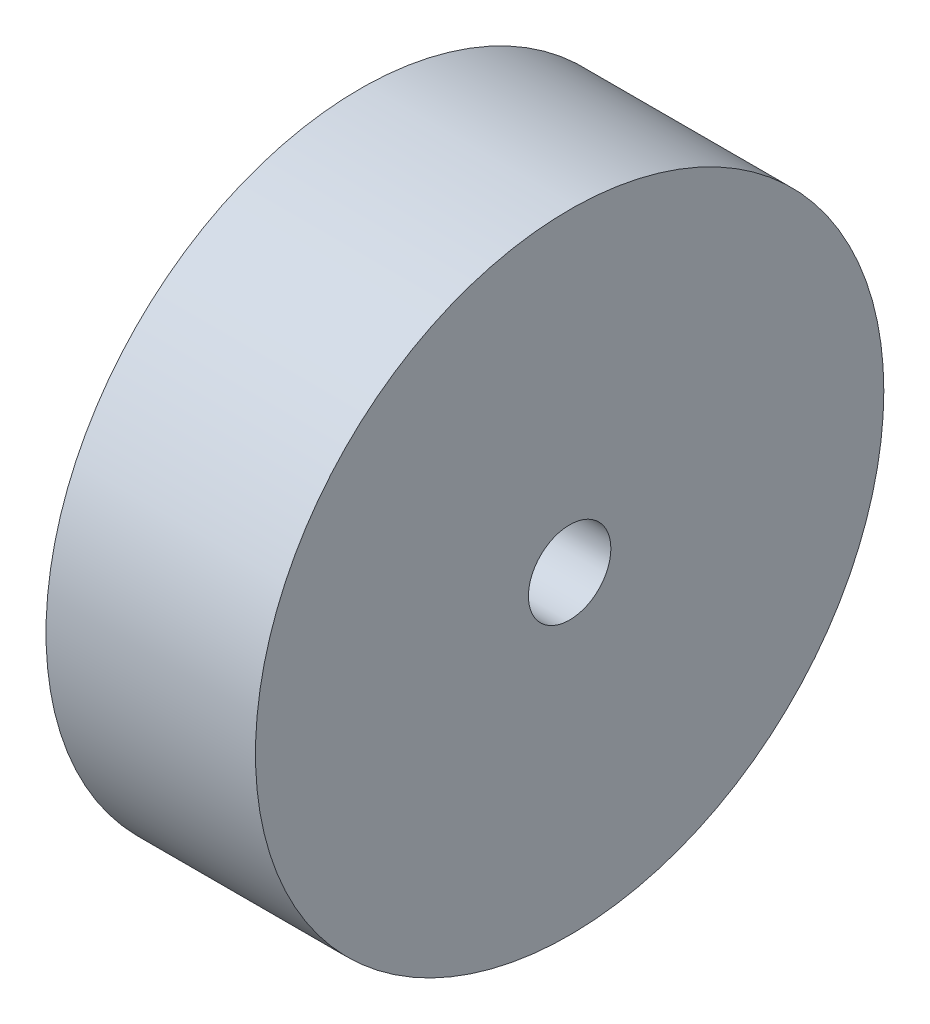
SolidWorks part; units mm, degrees
ref_plane "Front Plane" through (0, 0, 0) normal (0, 0, 1) x (1, 0, 0)
ref_plane "Top Plane" through (0, 0, 0) normal (0, 1, 0) x (1, 0, 0)
ref_plane "Right Plane" through (0, 0, 0) normal (1, 0, 0) x (0, 0, -1)
sketch "Sketch1" plane through (0, 0, 0) normal (1, 0, 0) x (0, 0, -1)
  circle A0 centre (0, 0) radius 38.1
  circle A1 centre (0, 0) radius 5
  dimension "D1" = 76.2
  dimension "D2" = 10
extrude "Boss-Extrude1" add sketch "Sketch1" along normal blind 25.4
